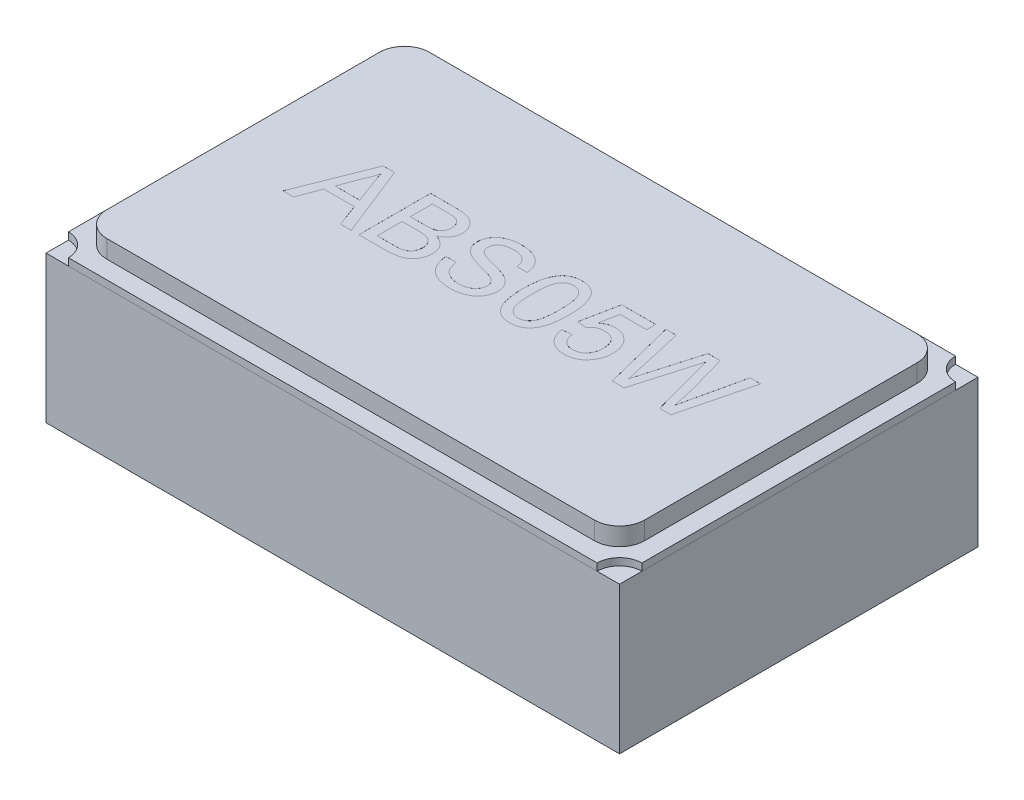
SolidWorks part; units mm, degrees
ref_plane "Front Plane" through (0, 0, 0) normal (0, 0, 1) x (1, 0, 0)
ref_plane "Top Plane" through (0, 0, 0) normal (0, 1, 0) x (1, 0, 0)
ref_plane "Right Plane" through (0, 0, 0) normal (1, 0, 0) x (0, 0, -1)
sketch "Sketch1" plane through (0, 0, 0) normal (0, 1, 0) x (1, 0, 0)
  line L0 (0, 0.5) -> (0, -0.5) construction
  line L1 (0, -55) -> (0, 55) construction
  line L2 (0.8, 0) -> (-0.8, 0) construction
  line L3 (-55, 0) -> (55, 0) construction
  line L5 (-0.8, 0.5) -> (0.8, 0.5)
  line L6 (-0.8, 0.5) -> (-0.8, -0.5)
  line L7 (-0.8, -0.5) -> (0.8, -0.5)
  line L8 (0.8, 0.5) -> (0.8, -0.5)
  dimension "D1" = 1.6
  dimension "D2" = 1
extrude "Boss-Extrude1" add sketch "Sketch1" along normal blind 0.48
sketch "Sketch2" plane through (0, 0, 0) normal (0, 1, 0) x (1, 0, 0)
  line L0 (0, 0.5) -> (0, -0.5) construction
  line L1 (-0.75, 0.45) -> (0.75, 0.45)
  line L2 (-0.75, 0.45) -> (-0.75, -0.45)
  line L3 (-0.75, -0.45) -> (0.75, -0.45)
  line L4 (-0.8, 0.5) -> (-0.8, -0.5)
  line L5 (-0.8, -0.5) -> (0.8, -0.5)
  line L6 (0.8, -0.5) -> (0.8, 0.5)
  line L7 (0.8, 0.5) -> (-0.8, 0.5)
  line L8 (-0.8, 0.5) -> (-0.8, -0.5)
  line L9 (-0.8, -0.5) -> (0.8, -0.5)
  line L10 (0.8, -0.5) -> (0.8, 0.5)
  line L11 (0.8, 0.5) -> (-0.8, 0.5)
  line L12 (0.75, 0.45) -> (0.75, -0.45)
  line L13 (0.8, 0) -> (-0.8, 0) construction
  line L14 (-0.275, 0) -> (0.275, 0) construction
  line L15 (-0.8, -0.5) -> (0.8, -0.5) construction
  line L16 (0.8, -0.5) -> (0.8, 0.5) construction
  dimension "D2" = 1.5
  dimension "D3" = 0.9
  dimension "D1" = 0
extrude "Cut-Extrude1" cut sketch "Sketch2" against normal blind 0.07 from surface at 0.48
sketch "Sketch3" plane through (0, 0, 0) normal (0, 1, 0) x (1, 0, 0)
  line L0 (0, 0.5) -> (0, -0.5) construction
  line L1 (-0.73, 0.43) -> (-0.53, 0.43)
  line L2 (-0.73, 0.43) -> (-0.73, -0.43)
  line L3 (-0.73, -0.43) -> (-0.33, -0.43)
  line L4 (-0.33, 0.23) -> (-0.33, -0.43)
  line L5 (0, -0.275) -> (0, 0.275) construction
  line L6 (0.8, 0) -> (-0.8956, 0) construction
  line L7 (-0.275, 0) -> (0.275, 0) construction
  line L8 (-0.8, -0.5) -> (-0.8, 0.5) construction
  line L9 (0.33, 0.43) -> (0.73, 0.43)
  line L10 (0.33, 0.43) -> (0.33, -0.43)
  line L11 (0.33, -0.43) -> (0.73, -0.43)
  line L12 (0.73, 0.43) -> (0.73, -0.43)
  line L13 (-0.53, 0.43) -> (-0.33, 0.23)
  line L14 (0.8, 0.5) -> (0.8, -0.5) construction
  line L15 (-0.8, 0.5) -> (0.8, 0.5) construction
  line L16 (0.8, -0.5) -> (-0.8, -0.5) construction
  point P20 (-0.33, 0.43)
  dimension "D1" = 0.86
  dimension "D2" = 0.07
  dimension "D3" = 0.4
  dimension "D4" = 0.2
  dimension "D5" = 0.2
fillet "Fillet1" radius 0.07 4 edges at (0.75, 0.445, 0.45) (0.75, 0.445, -0.45) (-0.75, 0.445, -0.45) (-0.75, 0.445, 0.45)
sketch "Sketch4" plane through (0, 0, 0) normal (0, 1, 0) x (1, 0, 0)
  text T0 "ABS05W" font "Arial" height 0.2
extrude "Cut-Extrude2" cut sketch "Sketch4" against normal blind 0.0001 from surface at 0.48
extrude "Boss-Extrude4" add sketch "Sketch3" against normal blind 0.02
sketch "Sketch5" plane through (0, 0.41, 0) normal (0, 1, 0) x (-1, 0, 0)
  line L0 (-0.75, -0.38) -> (-0.75, 0.38) construction
  line L1 (-0.68, 0.45) -> (0.68, 0.45) construction
  line L2 (0.75, 0.38) -> (0.75, -0.38) construction
  line L3 (0.68, -0.45) -> (-0.68, -0.45) construction
  line L4 (-0.75, -0.38) -> (-0.75, 0.38)
  line L5 (-0.68, 0.45) -> (0.68, 0.45)
  line L6 (0.75, 0.38) -> (0.75, -0.38)
  line L7 (0.68, -0.45) -> (-0.68, -0.45)
  line L8 (-0.8, -0.5) -> (-0.8, 0.5) construction
  line L9 (-0.8, 0.5) -> (0.8, 0.5) construction
  line L10 (0.8, 0.5) -> (0.8, -0.5) construction
  line L11 (0.8, -0.5) -> (-0.8, -0.5) construction
  line L12 (-0.8, -0.4375) -> (-0.8, 0.4375)
  line L13 (-0.7375, 0.5) -> (0.7375, 0.5)
  line L14 (0.8, 0.4375) -> (0.8, -0.4375)
  line L15 (0.7375, -0.5) -> (-0.7375, -0.5)
  arc A0 (-0.75, -0.38) -> (-0.68, -0.45) centre (-0.68, -0.38) ccw construction
  arc A1 (-0.68, 0.45) -> (-0.75, 0.38) centre (-0.68, 0.38) ccw construction
  arc A2 (0.75, 0.38) -> (0.68, 0.45) centre (0.68, 0.38) ccw construction
  arc A3 (0.68, -0.45) -> (0.75, -0.38) centre (0.68, -0.38) ccw construction
  arc A4 (-0.75, -0.38) -> (-0.68, -0.45) centre (-0.68, -0.38) ccw
  arc A5 (-0.68, 0.45) -> (-0.75, 0.38) centre (-0.68, 0.38) ccw
  arc A6 (0.75, 0.38) -> (0.68, 0.45) centre (0.68, 0.38) ccw
  arc A7 (0.68, -0.45) -> (0.75, -0.38) centre (0.68, -0.38) ccw
  arc A8 (0.8, -0.4375) -> (0.7375, -0.5) centre (0.8, -0.5) ccw
  arc A9 (-0.7375, -0.5) -> (-0.8, -0.4375) centre (-0.8, -0.5) ccw
  arc A10 (-0.8, 0.4375) -> (-0.7375, 0.5) centre (-0.8, 0.5) ccw
  arc A11 (0.7375, 0.5) -> (0.8, 0.4375) centre (0.8, 0.5) ccw
  dimension "D1" = 0.125
extrude "Boss-Extrude5" add sketch "Sketch5" along normal blind 0.02 separate body
